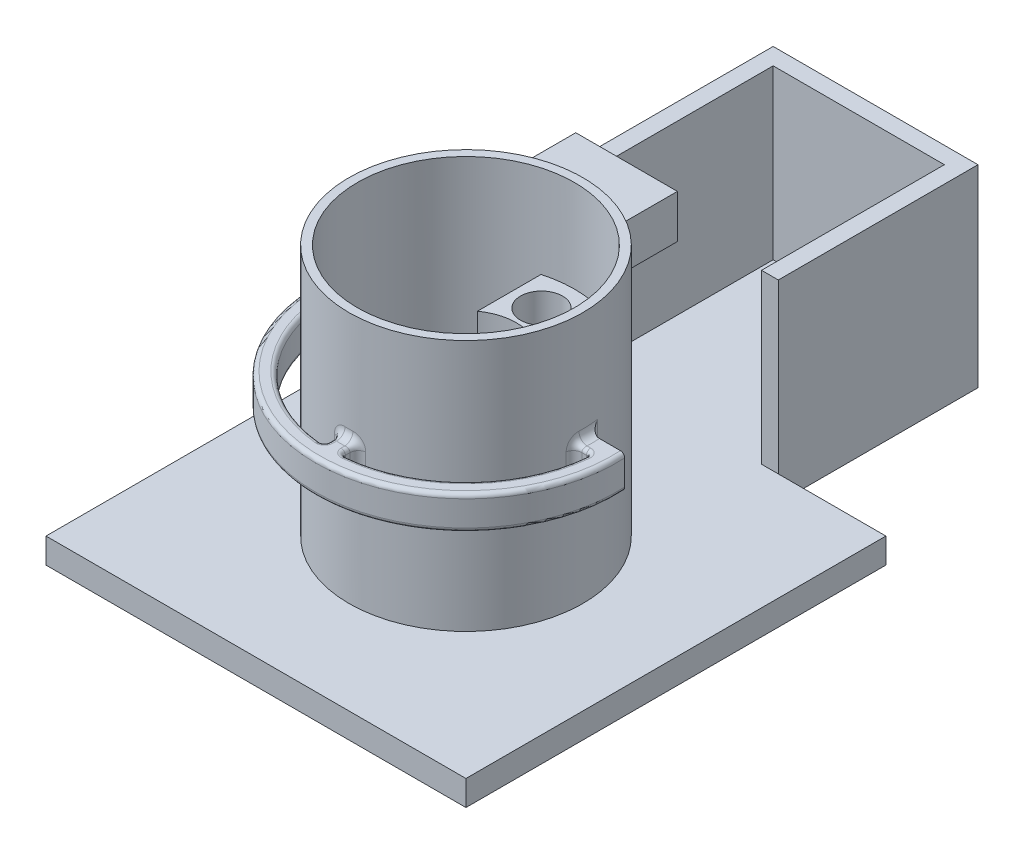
SolidWorks part; units mm, degrees
ref_plane "Front Plane" through (0, 0, 0) normal (0, 0, 1) x (1, 0, 0)
ref_plane "Top Plane" through (0, 0, 0) normal (0, 1, 0) x (1, 0, 0)
ref_plane "Right Plane" through (0, 0, 0) normal (1, 0, 0) x (0, 0, -1)
sketch "Sketch1" plane through (0, 0, 0) normal (0, 1, 0) x (1, 0, 0)
  circle A0 centre (0, 0) radius 13.925
  circle A1 centre (0, 0) radius 12.925
  dimension "D1" = 25.85
  dimension "D2" = 1
extrude "Boss-Extrude1" add sketch "Sketch1" along normal blind 20
sketch "Sketch2" plane through (0, 0, 0) normal (0, -1, 0) x (1, 0, 0)
  circle A0 centre (0, 0) radius 6
  circle A1 centre (0, 0) radius 13.925
  circle A3 centre (0, 0) radius 13.925 construction
  dimension "D1" = 12
extrude "Boss-Extrude2" add sketch "Sketch2" against normal blind 1
sketch "Sketch3" plane through (0, 1, 0) normal (0, 1, 0) x (1, 0, 0)
  line L0 (0, -6) -> (0, -12.925) construction
  line L1 (-3.5, 12.4421) -> (-3.5, 4.8734)
  line L2 (3.5, 12.4421) -> (3.5, 4.8734)
  line L3 (-3.5, 0) -> (-3.5, -13.925) construction
  line L4 (3.5, 0) -> (3.5, -13.925) construction
  line L5 (0, 0) -> (0, -13.925) construction
  line L6 (-3.5, -4.8734) -> (-3.5, -12.4421)
  line L7 (3.5, -4.8734) -> (3.5, -12.4421)
  circle A0 centre (0, -9) radius 2.5
  circle A1 centre (0, 9) radius 2.5
  arc A3 (-3.5, -12.4421) -> (3.5, -12.4421) centre (0, 0) ccw
  arc A5 (3.5, 4.8734) -> (-3.5, 4.8734) centre (0, 0) ccw
  arc A7 (3.5, 12.4421) -> (-3.5, 12.4421) centre (0, 0) ccw
  arc A8 (-3.5, -4.8734) -> (3.5, -4.8734) centre (0, 0) ccw
  circle A9 centre (0, 0) radius 12.925 construction
  circle A10 centre (0, 0) radius 6 construction
  dimension "D1" = 5
  dimension "D2" = 3.5
  dimension "D3" = 3.5
extrude "Boss-Extrude3" add sketch "Sketch3" along normal up to surface (19 mm away)
sketch "Sketch4" plane through (0, 20, 0) normal (0, 1, 0) x (1, 0, 0)
  circle A0 centre (0, 0) radius 13.925
  circle A1 centre (0, 0) radius 13.925 construction
  circle A2 centre (0, 0) radius 12.925
  circle A3 centre (0, 0) radius 12.925 construction
extrude "Boss-Extrude4" add sketch "Sketch4" along normal blind 10
sketch "Sketch5" plane through (0, 0, -19.127) normal (0, 0, 1) x (1, 0, 0)
  line L0 (6.05, 23.825) -> (-6.05, 23.825)
  line L1 (3.5, 25.325) -> (3.5, 23.825) construction
  line L2 (3.5, 28.075) -> (3.5, 29) construction
  line L4 (-4.75, 25.4) -> (4.75, 25.4)
  line L5 (6.05, 26.7) -> (6.05, 29)
  line L6 (6.05, 29) -> (-6.05, 29)
  line L7 (-6.05, 29) -> (-6.05, 26.7)
  line L9 (6.05, 23.825) -> (6.05, 29)
  line L10 (6.05, 29) -> (-6.05, 29)
  line L11 (-6.05, 29) -> (-6.05, 23.825)
  circle A0 centre (3.5, 26.7) radius 1
  circle A1 centre (3.5, 26.7) radius 1.375
  arc A2 (4.75, 25.4) -> (6.05, 26.7) centre (4.75, 26.7) ccw
  arc A3 (-6.05, 26.7) -> (-4.75, 25.4) centre (-4.75, 26.7) ccw
  circle A9 centre (-3.5, 26.7) radius 1.375
  circle A10 centre (-3.5, 26.7) radius 1 construction
  dimension "D2" = 2.75
  dimension "D3" = 1.5
  dimension "D1" = 0
extrude "Boss-Extrude5" add sketch "Sketch5" along normal up to surface (6.0832 mm away) contours A9 L11 L0 L9 A1 M11 M16 M12 | A9 A1 M11 M12 M13 M14 M15 M16 M9 | M9
sketch "Sketch6" plane through (0, 0, 0) normal (0, -1, 0) x (1, 0, 0)
  line L1 (-25, 25) -> (25, 25)
  line L2 (-25, 25) -> (-25, -25)
  line L3 (-25, -25) -> (25, -25)
  line L4 (25, 25) -> (25, -25)
  line L5 (-25, 25) -> (25, -25) construction
  line L6 (-25, -25) -> (25, 25) construction
  circle A0 centre (0, 0) radius 6
  circle A2 centre (0, 0) radius 6 construction
  point P0 (0, 0)
  dimension "D1" = 50
extrude "Boss-Extrude6" add sketch "Sketch6" along normal blind 3
sketch "Sketch7" plane through (0, -3, 0) normal (0, -1, 0) x (1, 0, 0)
  line L0 (14, 14) -> (16.6543, 14) construction
  line L1 (-14, 14) -> (14, 14) construction
  line L2 (-14, 14) -> (-14, -14) construction
  line L3 (-14, -14) -> (14, -14) construction
  line L4 (14, 14) -> (14, -14) construction
  line L5 (-14, 14) -> (14, -14) construction
  line L6 (-14, -14) -> (14, 14) construction
  line L7 (-14, 14) -> (-16.6543, 14) construction
  line L8 (-14, -14) -> (-16.6543, -14) construction
  line L9 (14, -14) -> (16.6543, -14) construction
  line L10 (-16.6543, 14) -> (-11.3457, 14)
  line L11 (11.3457, 14) -> (16.6543, 14)
  line L12 (-16.6543, -14) -> (-11.3457, -14)
  line L13 (11.3457, -14) -> (16.6543, -14)
  arc A0 (16.6543, 14) -> (11.3457, 14) centre (14, 14) ccw
  arc A1 (16.6543, -14) -> (11.3457, -14) centre (14, -14) ccw
  arc A2 (-11.3457, -14) -> (-16.6543, -14) centre (-14, -14) ccw
  arc A3 (-11.3457, 14) -> (-16.6543, 14) centre (-14, 14) ccw
  point P0 (0, 0)
  dimension "D2" = 5.3086
  dimension "D1" = 28
sketch "Sketch8" plane through (0, 1, 0) normal (0, 1, 0) x (1, 0, 0)
  circle A0 centre (0, 9) radius 2.5
  circle A1 centre (0, -9) radius 2.5
  circle A2 centre (0, 9) radius 2.5 construction
extrude "Cut-Extrude1" cut sketch "Sketch8" against normal blind 1
sketch "Sketch9" plane through (0, 20, 0) normal (0, 1, 0) x (1, 0, 0)
  line L2 (3.5, 4.8734) -> (3.5, 12.4421)
  line L3 (-3.5, 12.4421) -> (-3.5, 4.8734)
  line L4 (3.5, 4.8734) -> (3.5, 12.4421)
  line L5 (-3.5, 12.4421) -> (-3.5, 4.8734)
  line L6 (-3.5, -4.8734) -> (-3.5, -12.4421)
  line L7 (3.5, -12.4421) -> (3.5, -4.8734)
  line L8 (-3.5, -4.8734) -> (-3.5, -12.4421)
  line L9 (3.5, -12.4421) -> (3.5, -4.8734)
  arc A2 (3.5, 12.4421) -> (-3.5, 12.4421) centre (0, 0) ccw
  arc A3 (3.5, 4.8734) -> (-3.5, 4.8734) centre (0, 0) ccw
  arc A4 (3.5, 12.4421) -> (-3.5, 12.4421) centre (0, 0) ccw
  arc A5 (3.5, 4.8734) -> (-3.5, 4.8734) centre (0, 0) ccw
  arc A6 (-3.5, -12.4421) -> (3.5, -12.4421) centre (0, 0) ccw
  arc A7 (-3.5, -4.8734) -> (3.5, -4.8734) centre (0, 0) ccw
  arc A8 (-3.5, -12.4421) -> (3.5, -12.4421) centre (0, 0) ccw
  arc A9 (-3.5, -4.8734) -> (3.5, -4.8734) centre (0, 0) ccw
  dimension "D1" = 0
  dimension "D2" = 0
extrude "Cut-Extrude2" cut sketch "Sketch9" against normal blind 1
sketch "Sketch11" plane through (0, -3, 0) normal (0, -1, 0) x (1, 0, 0)
  line L0 (10.195, -25) -> (10.195, -46.775)
  line L2 (9.945, -26.025) -> (9.945, -46.525) construction
  line L3 (9.945, -46.525) -> (-9.945, -46.525) construction
  line L4 (-9.945, -26.025) -> (-9.945, -46.525) construction
  line L5 (10.195, -46.775) -> (-10.195, -46.775)
  line L6 (-10.195, -25) -> (-10.195, -46.775)
  line L7 (-25, -25) -> (25, -25) construction
  line L8 (10.195, -26.025) -> (10.195, -46.775) construction
  line L9 (-10.195, -26.025) -> (-10.195, -46.775) construction
  line L10 (12.195, -25) -> (12.195, -48.775)
  line L11 (12.195, -48.775) -> (-12.195, -48.775)
  line L12 (-12.195, -25) -> (-12.195, -48.775)
  line L13 (12.195, -25) -> (10.195, -25)
  line L14 (-10.195, -25) -> (-12.195, -25)
  dimension "D1" = 0.25
  dimension "D2" = 2
extrude "Boss-Extrude7" add sketch "Sketch11" against normal blind 23
sketch "Sketch12" plane through (0, -3, 0) normal (0, -1, 0) x (1, 0, 0)
  line L1 (12.195, -25) -> (-12.195, -25)
  line L2 (12.195, -25) -> (12.195, -48.775)
  line L3 (12.195, -48.775) -> (-12.195, -48.775)
  line L4 (-12.195, -25) -> (-12.195, -48.775)
extrude "Boss-Extrude8" add sketch "Sketch12" against normal up to surface (3 mm away)
ref_plane "Plane1" through (0, 15, 0) normal (0, 1, 0) x (1, 0, 0)
sketch "Sketch13" plane through (0, 15, 0) normal (0, 1, 0) x (1, 0, 0)
  line L0 (0, -13.925) -> (0, -15.925) construction
  line L1 (-1, -13.889) -> (-1, -15.8936)
  line L2 (1, -13.889) -> (1, -15.8936)
  line L3 (1, -13.925) -> (1, -15.925) construction
  line L4 (-1, -13.925) -> (-1, -15.925) construction
  line L5 (13.925, 0) -> (15.925, 0) construction
  line L6 (13.889, -1) -> (15.8936, -1)
  line L7 (13.889, 1) -> (17.8971, 1)
  line L8 (13.925, -1) -> (15.925, -1) construction
  line L9 (13.925, 1) -> (15.925, 1) construction
  line L10 (0, 0) -> (0, -2.3136) construction
  line L11 (-13.925, 0) -> (-15.925, 0) construction
  line L12 (-13.889, 1) -> (-17.8971, 1)
  line L13 (-13.889, -1) -> (-15.8936, -1)
  arc A0 (1, -15.8936) -> (15.8936, -1) centre (0, 0) ccw
  circle A1 centre (0, 0) radius 13.925
  circle A2 centre (0, 0) radius 13.925 construction
  arc A3 (-17.8971, 1) -> (17.8971, 1) centre (0, 0) ccw
  circle A4 centre (0, 0) radius 15.925 construction
  arc A6 (-15.8936, -1) -> (-1, -15.8936) centre (0, 0) ccw
  circle A7 centre (0, 0) radius 17.925 construction
  dimension "D1" = 2
  dimension "D2" = 2
  dimension "D3" = 1
  dimension "D4" = 1
  dimension "D5" = 1
  dimension "D6" = 1
extrude "Boss-Extrude9" add sketch "Sketch13" along normal mid plane 4 contours A6 L13 A1 L12 A3 L7 L6 A0 L2 L1
fillet "Fillet1" radius 0.5 18 edges at (-11.2607, 17, 11.2607) (-11.2607, 13, 11.2607) (0, 13, 17.925) (11.2607, 13, 11.2607) (0, 17, 17.925) (11.2607, 17, 11.2607) (14.8913, 17, 1) (14.8913, 13, 1) (-1, 17, 14.8913) (-1, 13, 14.8913) (1, 17, 14.8913) (1, 13, 14.8913) (-14.8913, 17, 1) (-14.8913, 13, 1) (15.8936, 15, 1) (-1, 15, 15.8936) (1, 15, 15.8936) (-15.8936, 15, 1)
fillet "Fillet2" radius 1 20 edges at (13.9227, 13, -0.2504) (13.9227, 17, -0.2504) (-13.9227, 13, -0.2504) (-13.9227, 17, -0.2504) (-13.889, 15, 1) (-13.889, 15, -1) (13.889, 15, -1) (13.889, 15, 1) (-1, 15, 13.889) (1, 15, 13.889) (0.8125, 16.8903, 13.9013) (0, 17, 13.925) (-0.8909, 16.8118, 13.8965) (-0.8125, 13.1097, 13.9013) (0, 13, 13.925) (0.8909, 13.1882, 13.8965) (13.9013, 13.1097, 0.8125) (13.8965, 16.8118, 0.8909) (-13.8965, 13.1882, 0.8909) (-13.9013, 16.8903, 0.8125)
